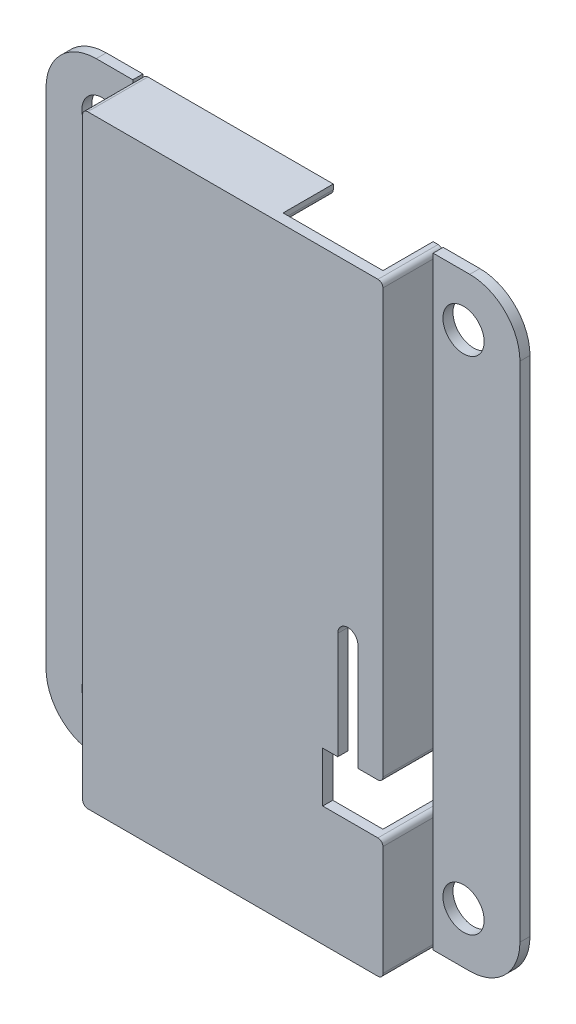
SolidWorks part; units mm, degrees
ref_plane "Front Plane" through (0, 0, 0) normal (0, 0, 1) x (1, 0, 0)
ref_plane "Top Plane" through (0, 0, 0) normal (0, 1, 0) x (1, 0, 0)
ref_plane "Right Plane" through (0, 0, 0) normal (1, 0, 0) x (0, 0, -1)
sketch "Sketch1" plane through (0, 0, 0) normal (0, 0, 1) x (1, 0, 0)
  line L0 (-7.092, 13.5001) -> (-7.092, -2.526) construction
  line L1 (-5.822, -3.796) -> (5.822, -3.796) construction
  line L2 (7.092, 0.014) -> (4.552, 0.014) construction
  line L3 (4.552, 0.014) -> (4.552, -2.526) construction
  line L4 (4.552, -2.526) -> (7.092, -2.526) construction
  line L5 (7.092, 0.014) -> (7.092, 30.3119) construction
  line L6 (4.5776, 30.3119) -> (4.5776, 17.3101) construction
  line L7 (2.0376, 14.7701) -> (-5.822, 14.7701) construction
  line L8 (7.092, 30.3119) -> (4.5776, 30.3119) construction
  line L9 (7.092, 30.3119) -> (7.092, -13.5001) construction
  line L10 (5.822, -14.7701) -> (-5.822, -14.7701) construction
  line L11 (11.9945, 12.2301) -> (11.9945, -12.2301) construction
  line L12 (0, 12.6809) -> (0, -14.7701) construction
  line L13 (-9.1387, 12.6809) -> (9.1387, 12.6809) construction
  line L14 (-9.4545, 14.7701) -> (9.4545, 14.7701) construction
  line L15 (-11.9945, 12.2301) -> (-11.9945, -12.2301) construction
  line L16 (-9.4545, -14.7701) -> (9.4545, -14.7701) construction
  line L17 (5.822, -10.4808) -> (-5.822, -10.4808) construction
  line L18 (7.092, -9.2108) -> (4.552, -9.2108) construction
  line L19 (4.552, -9.2108) -> (4.552, -6.6708) construction
  line L20 (5.8232, -7.9408) -> (5.8232, -1.256) construction
  line L21 (5.3152, -7.9408) -> (5.3152, -1.256) construction
  line L22 (6.3312, -7.9408) -> (6.3312, -1.256) construction
  line L23 (4.552, -6.6708) -> (7.092, -6.6708) construction
  line L24 (-11.9945, 0) -> (0, 0) construction
  arc A0 (-7.092, -2.526) -> (-5.822, -3.796) centre (-5.822, -2.526) ccw construction
  arc A1 (5.822, -3.796) -> (7.092, -2.526) centre (5.822, -2.526) ccw construction
  arc A2 (2.0376, 14.7701) -> (4.5776, 17.3101) centre (2.0376, 17.3101) ccw construction
  arc A3 (-5.822, 14.7701) -> (-7.092, 13.5001) centre (-5.822, 13.5001) ccw construction
  circle A4 centre (-9.1387, 12.6809) radius 1.0427 construction
  circle A5 centre (9.1387, 12.6809) radius 1.0427 construction
  circle A6 centre (9.1387, -12.6809) radius 1.0427 construction
  circle A7 centre (-9.1387, -12.6809) radius 1.0427 construction
  arc A8 (11.9945, 12.2301) -> (9.4545, 14.7701) centre (9.4545, 12.2301) ccw construction
  arc A9 (11.9945, -12.2301) -> (9.4545, -14.7701) centre (9.4545, -12.2301) cw construction
  arc A10 (-9.4545, -14.7701) -> (-11.9945, -12.2301) centre (-9.4545, -12.2301) cw construction
  arc A11 (-11.9945, 12.2301) -> (-9.4545, 14.7701) centre (-9.4545, 12.2301) cw construction
  arc A12 (5.822, -10.4808) -> (7.092, -9.2108) centre (5.822, -9.2108) ccw construction
  arc A15 (5.3152, -7.9408) -> (6.3312, -7.9408) centre (5.8232, -7.9408) ccw construction
  arc A16 (6.3312, -1.256) -> (5.3152, -1.256) centre (5.8232, -1.256) ccw construction
  point P53 (5.8232, -4.5984)
  dimension "D1" = 2.54
  dimension "D2" = 10.9741
sketch "Sketch8" plane through (0, 0, 0) normal (0, 0, 1) x (1, 0, 0)
  line L0 (6.3312, -6.6708) -> (7.6, -6.6708)
  line L1 (7.6, -6.6708) -> (7.6, 15.2781)
  line L8 (6.3312, -7.9408) -> (6.3312, -1.256) construction
  line L9 (6.3312, -6.6708) -> (6.3312, -1.256)
  line L10 (4.552, -9.2108) -> (4.552, -6.6708) construction
  line L11 (7.092, -9.2108) -> (4.552, -9.2108) construction
  line L12 (4.552, -6.6708) -> (7.092, -6.6708) construction
  line L13 (4.552, -9.2108) -> (4.552, -6.6708)
  line L14 (7.6, -9.2108) -> (4.552, -9.2108)
  line L15 (4.552, -6.6708) -> (5.3152, -6.6708)
  line L16 (5.3152, -7.9408) -> (5.3152, -1.256) construction
  line L17 (5.3152, -6.6708) -> (5.3152, -1.256)
  line L20 (-7.6, 15.2781) -> (-7.6, -15.2781)
  line L21 (7.6, -15.2781) -> (-7.6, -15.2781)
  line L22 (7.6, -15.2781) -> (7.6, -9.2108)
  line L23 (7.6, 15.2781) -> (-7.6, 15.2781)
  arc A0 (6.3312, -1.256) -> (5.3152, -1.256) centre (5.8232, -1.256) ccw construction
  arc A1 (6.3312, -1.256) -> (5.3152, -1.256) centre (5.8232, -1.256) ccw
extrude "Boss-Extrude2" add sketch "Sketch8" along normal blind 3.048 contours L23 L20 L21 L22 L14 L13 L15 L17 A1 L9 L0 L1
shell "Shell2" thickness 0.508
sketch "Sketch10" plane through (0, 15.2781, 0) normal (0, 1, 0) x (1, 0, 0)
  line L0 (7.6, 0) -> (7.092, 0) construction
  line L1 (7.092, 0) -> (2.0376, 0)
  line L2 (2.0376, 0) -> (2.0376, -2.54)
  line L3 (2.0376, -2.54) -> (7.092, -2.54)
  line L4 (7.092, -2.54) -> (7.092, 0)
  point P0 (2.0376, 0)
extrude "Cut-Extrude1" cut sketch "Sketch10" against normal up to vertex (30.0481 mm away)
fillet "Fillet2" radius 0.254 7 edges at (-7.6, 15.2781, 1.524) (7.6, 15.2781, 1.524) (2.0376, 14.7701, 1.27) (7.6, -6.6708, 1.524) (7.6, -9.2108, 1.524) (7.6, -15.2781, 1.524) (-7.6, -15.2781, 1.524)
sketch "Sketch11" plane through (0, 0, 0) normal (0, 0, 1) x (1, 0, 0)
  line L0 (-11.9945, 12.2301) -> (-11.9945, -12.2301) construction
  line L1 (-11.9945, 12.7409) -> (-11.9945, -12.7291)
  line L2 (-7.6, 15.2809) -> (-9.4545, 15.2809)
  line L3 (-7.6, 15.0241) -> (-7.6, -15.0241) construction
  line L4 (-7.6, 15.2809) -> (-7.6, -15.2691)
  line L5 (-7.6, -15.2691) -> (-9.4545, -15.2691)
  circle A0 centre (-9.1387, 12.6809) radius 1.0427 construction
  circle A1 centre (-9.1387, 12.6809) radius 1.0427
  circle A2 centre (-9.1387, -12.6809) radius 1.0427 construction
  circle A3 centre (-9.1387, -12.6809) radius 1.0427
  arc A4 (-11.9945, -12.7291) -> (-9.4545, -15.2691) centre (-9.4545, -12.7291) ccw
  arc A5 (-11.9945, 12.7409) -> (-9.4545, 15.2809) centre (-9.4545, 12.7409) cw
  dimension "D1" = 2.54
extrude "Boss-Extrude3" add sketch "Sketch11" along normal blind 0.508
mirror "Mirror1" about plane through (0, 0, 0) normal (1, 0, 0) of "Boss-Extrude3"
